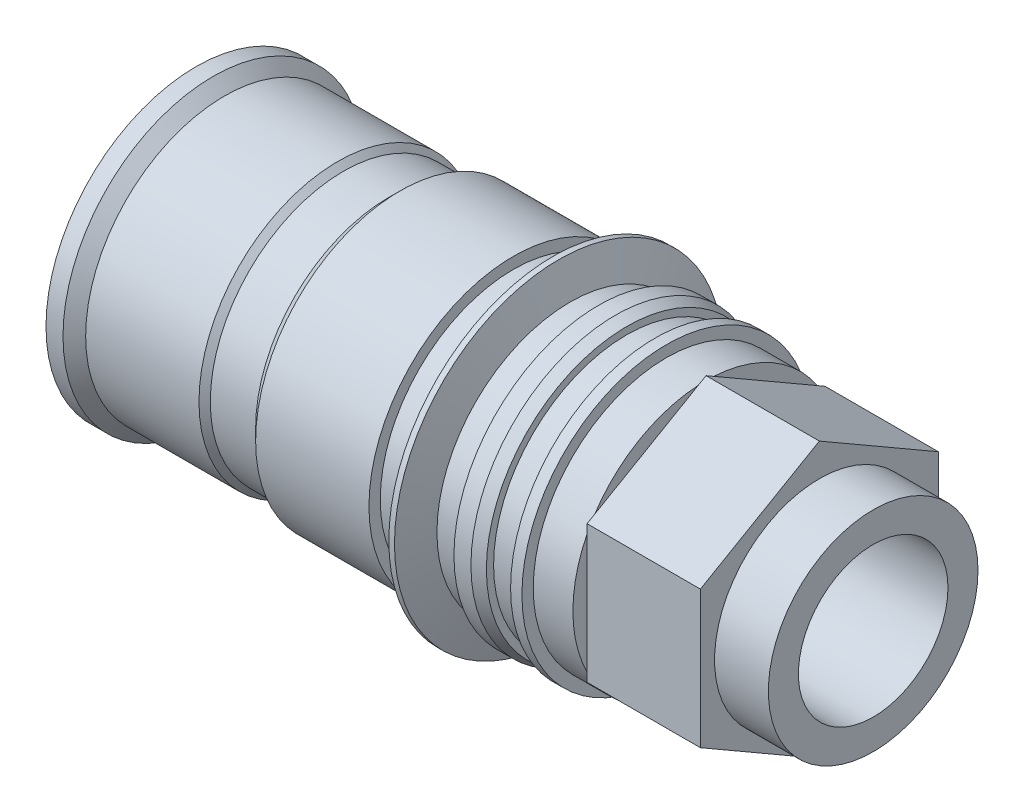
SolidWorks part; units mm, degrees
ref_plane "Alzado" through (0, 0, 0) normal (0, 0, 1) x (1, 0, 0)
ref_plane "Planta" through (0, 0, 0) normal (0, 1, 0) x (1, 0, 0)
ref_plane "Vista lateral" through (0, 0, 0) normal (1, 0, 0) x (0, 0, -1)
sketch "Croquis1" plane through (0, 0, 0) normal (0, 0, 1) x (1, 0, 0)
  line L0 (0, 0) -> (150.0259, 0) construction
  line L1 (0, 0) -> (0, 26.5)
  line L2 (0, 26.5) -> (3, 26.5)
  line L3 (3, 26.5) -> (5, 24.5)
  line L4 (5, 24.5) -> (25, 24.5)
  line L5 (25, 24.5) -> (26, 23.5)
  line L6 (26, 23.5) -> (34, 23.5)
  line L7 (34, 23.5) -> (36, 25.5)
  line L8 (36, 25.5) -> (56, 25.5)
  line L9 (56, 25.5) -> (56, 23.5)
  line L10 (56, 23.5) -> (61, 23.5)
  line L11 (61, 23.5) -> (63, 28.995)
  line L12 (63, 28.995) -> (64, 28.995)
  line L13 (64, 28.995) -> (66, 23.5)
  line L14 (66, 23.5) -> (71, 23.5)
  line L15 (71, 23.5) -> (71, 25.5)
  line L16 (71, 25.5) -> (74, 25.5)
  line L17 (74, 25.5) -> (76, 24.7721)
  line L18 (76, 24.7721) -> (76, 23.5)
  line L19 (76, 23.5) -> (81, 23.5)
  line L20 (81, 23.5) -> (81, 25.5)
  line L21 (81, 25.5) -> (83, 25.5)
  line L22 (83, 25.5) -> (83, 23.5)
  line L23 (83, 23.5) -> (90, 23.5)
  line L24 (90, 23.5) -> (90, 0)
  line L25 (90, 0) -> (0, 0)
  dimension "D1" = 90
  dimension "D2" = 53
  dimension "D3" = 3
  dimension "D4" = 135
  dimension "D5" = 2
  dimension "D6" = 20
  dimension "D7" = 1
  dimension "D8" = 8
  dimension "D9" = 2
  dimension "D10" = 20
  dimension "D11" = 2
  dimension "D12" = 5
  dimension "D13" = 2
  dimension "D14" = 110
  dimension "D15" = 1
  dimension "D16" = 2
  dimension "D17" = 5
  dimension "D18" = 2
  dimension "D19" = 3
  dimension "D20" = 5
  dimension "D21" = 2
  dimension "D22" = 2
revolve "Revolución1" add sketch "Croquis1" angle 360 about L0
sketch "Croquis2" plane through (90, 0, 0) normal (1, 0, 0) x (0, 0, -1)
  line L1 (0, 24.2487) -> (-21, 12.1244)
  line L2 (-21, 12.1244) -> (-21, -12.1244)
  line L3 (-21, -12.1244) -> (0, -24.2487)
  line L4 (0, -24.2487) -> (21, -12.1244)
  line L5 (21, -12.1244) -> (21, 12.1244)
  line L6 (21, 12.1244) -> (0, 24.2487)
  circle A0 centre (0, 0) radius 21 construction
  dimension "D1" = 42
extrude "Saliente-Extruir1" add sketch "Croquis2" along normal blind 20
sketch "Croquis3" plane through (110, 0, 0) normal (1, 0, 0) x (0, 0, -1)
  circle A0 centre (0, 0) radius 18.5
  dimension "D1" = 37
extrude "Saliente-Extruir2" add sketch "Croquis3" along normal blind 9.5
sketch "Croquis4" plane through (119.5, 0, 0) normal (1, 0, 0) x (0, 0, -1)
  circle A0 centre (0, 0) radius 13.2
  dimension "D1" = 26.4
extrude "Cortar-Extruir1" cut sketch "Croquis4" against normal through all
